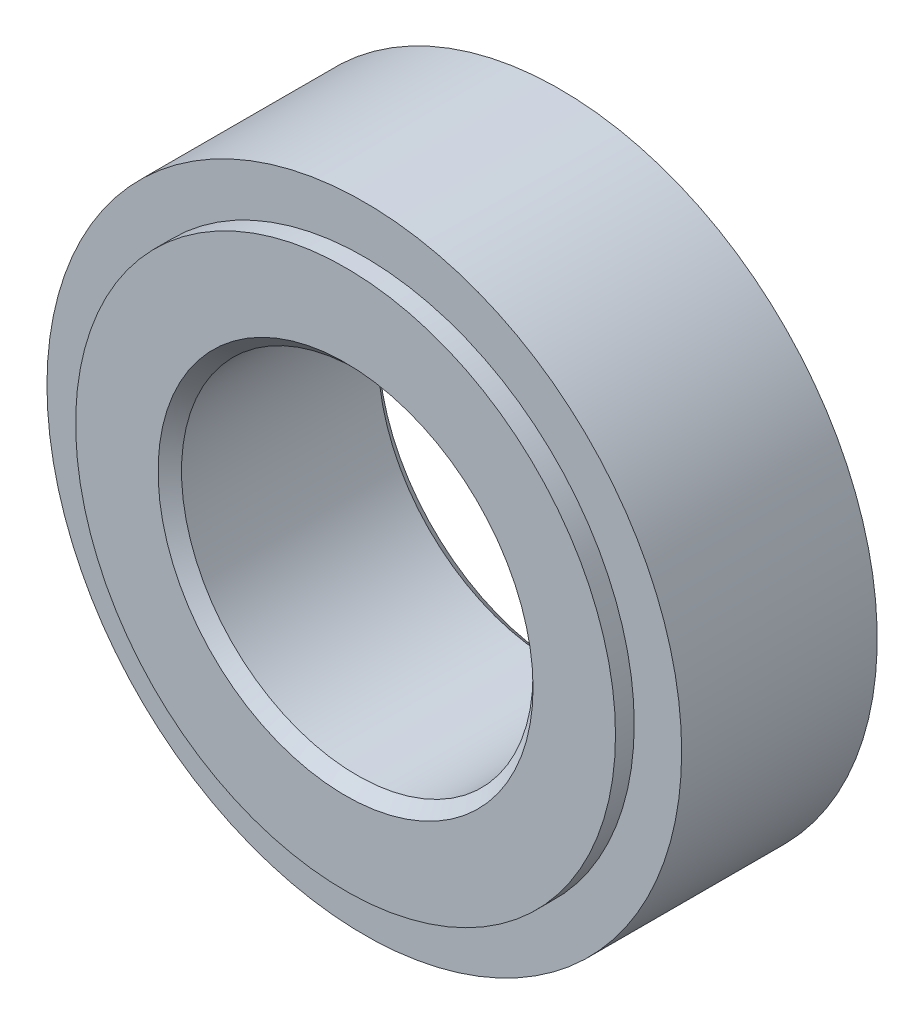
SolidWorks part; units mm, degrees
ref_plane "Front" through (0, 0, 0) normal (0, 0, 1) x (1, 0, 0)
ref_plane "Top" through (0, 0, 0) normal (0, 1, 0) x (1, 0, 0)
ref_plane "Right" through (0, 0, 0) normal (1, 0, 0) x (0, 0, -1)
sketch "Sketch1" plane through (0, 0, 0) normal (0, 0, 1) x (1, 0, 0)
  circle A0 centre (0, 0) radius 27.1
  dimension "OD" = 54.2
extrude "Extrude1" add sketch "Sketch1" along normal mid plane 18.8
sketch "Sketch2" plane through (0, 0, 9.4) normal (0, 0, 1) x (1, 0, 0)
  circle A0 centre (0, 0) radius 23.05
  dimension "MG" = 46.1
extrude "Cut-Extrude1" cut sketch "Sketch2" against normal blind 1.6 contours A0 M2
sketch "Sketch3" plane through (0, 0, -9.4) normal (0, 0, -1) x (-1, 0, 0)
  circle A0 centre (0, 0) radius 23.05
  dimension "MG" = 46.1
extrude "Cut-Extrude2" cut sketch "Sketch3" against normal blind 0.5 contours A0 M2
sketch "Sketch4" plane through (0, 0, 9.4) normal (0, 0, 1) x (1, 0, 0)
  circle A0 centre (0, 0) radius 15.01
  dimension "BORE" = 30.02
extrude "Cut-Extrude3" cut sketch "Sketch4" against normal through all
sketch "Sketch5" plane through (0, 0, -9.4) normal (0, 0, 1) x (1, 0, 0)
  point P0 (0, 18)
  point P1 (18, 0)
  point P2 (0, -18)
  point P3 (-18, 0)
  dimension "D1" = 18
  dimension "D2" = 18
  dimension "D3" = 18
  dimension "D4" = 18
hole_wizard "M5x0.8 Tapped Hole1" positions "3DSketch1" profile "Sketch6" tap size "M5x0.8" standard "Ansi Metric"
sketch3d "3DSketch1"
  point P0 (0, 32, -43.05)
  point P3 (-32, 0, -43.05)
  point P6 (32, 0, -43.05)
  point P9 (0, -32, -43.05)
sketch "Sketch6" plane through (0, 32, -43.05) normal (1, 0, 0) x (0, 1, 0)
  line L0 (0, 0) -> (0, 13.9618)
  line L1 (0, 13.9618) -> (2.1, 12.7)
  line L2 (2.1, 12.7) -> (2.1, 0)
  line L5 (2.1, 0) -> (0, 0)
  line L10 (0, 13.9618) -> (-2.1, 12.7) construction
  line L11 (0, -6.35) -> (0, 107.95) construction
  dimension "Tap Drill Dia." = 4.2
  dimension "Tap Drill Depth" = 12.7
  dimension "Drill Angle" = 118
chamfer "Chamfer1" distance 1 angle 45 2 edges at (15.01, 0, -9.4) (15.01, 0, 9.4)
sketch "Sketch7" plane through (0, 0, -39) normal (0, 0, -1) x (-1, 0, 0)
  point P0 (53.8815, 53.8815)
  point P1 (53.8815, -53.8815)
  point P3 (0, 76.2)
  point P4 (0, -76.2)
  point P5 (-53.8815, -53.8815)
  point P7 (-53.8815, 53.8815)
  dimension "D1" = 53.8815
  dimension "D2" = 53.8815
  dimension "D3" = 53.8815
  dimension "D4" = 53.8815
  dimension "D5" = 76.2
  dimension "D6" = 76.2
hole_wizard "Ø3.2 (3.2) Diameter Hole1" positions "3DSketch2" profile "Sketch8" hole size "Ø3.2" standard "Ansi Metric"
sketch3d "3DSketch2"
  point P0 (0, 76.2, -31.5)
  point P3 (0, -76.2, -31.5)
sketch "Sketch8" plane through (0, 76.2, -31.5) normal (1, 0, 0) x (0, 1, 0)
  line L0 (0, 0) -> (0, 4.8)
  line L1 (0, 4.8) -> (1.6, 4.8)
  line L2 (1.6, 4.8) -> (1.6, 0)
  line L5 (1.6, 0) -> (0, 0)
  line L10 (0, 4.8) -> (-1.6, 4.8) construction
  line L11 (0, -6.35) -> (0, 107.95) construction
  dimension "Hole Dia." = 3.2
  dimension "Hole Depth" = 4.8
  dimension "Drill Angle" = 180
hole_wizard "M6x1.0 Tapped Hole1" positions "3DSketch3" profile "Sketch9" tap size "M6x1.0" standard "Ansi Metric"
sketch3d "3DSketch3"
  point P0 (53.8815, 53.8815, -39)
  point P3 (-53.8815, 53.8815, -39)
  point P6 (-53.8815, -53.8815, -39)
  point P9 (53.8815, -53.8815, -39)
sketch "Sketch9" plane through (53.8815, 53.8815, -39) normal (1, 0, 0) x (0, 1, 0)
  line L0 (0, 0) -> (0, 14.2022)
  line L1 (0, 14.2022) -> (2.5, 12.7)
  line L2 (2.5, 12.7) -> (2.5, 0)
  line L5 (2.5, 0) -> (0, 0)
  line L10 (0, 14.2022) -> (-2.5, 12.7) construction
  line L11 (0, -6.35) -> (0, 107.95) construction
  dimension "Tap Drill Dia." = 5
  dimension "Tap Drill Depth" = 12.7
  dimension "Drill Angle" = 118
hole_wizard "Ø3.2 (3.2) Diameter Hole2" positions "3DSketch4" profile "Sketch10" hole size "Ø3.2" standard "Ansi Metric"
sketch3d "3DSketch4"
  point P1 (0, 6.8834, -34.4)
  point P4 (0, -6.8834, -34.4)
sketch "Sketch10" plane through (0, 6.8834, -34.4) normal (1, 0, 0) x (0, 1, 0)
  line L0 (0, 0) -> (0, 7.6)
  line L1 (0, 7.6) -> (1.6, 7.6)
  line L2 (1.6, 7.6) -> (1.6, 0)
  line L5 (1.6, 0) -> (0, 0)
  line L10 (0, 7.6) -> (-1.6, 7.6) construction
  line L11 (0, -6.35) -> (0, 107.95) construction
  dimension "Hole Dia." = 3.2
  dimension "Hole Depth" = 7.6
  dimension "Drill Angle" = 180
hole_wizard "M3x0.5 Tapped Hole1" positions "3DSketch5" profile "Sketch11" tap size "M3x0.5" standard "Ansi Metric"
sketch3d "3DSketch5"
  point P1 (6.8834, 0, -34.4)
  point P4 (-6.8834, 0, -34.4)
sketch "Sketch11" plane through (6.8834, 0, -34.4) normal (1, 0, 0) x (0, 1, 0)
  line L0 (0, 0) -> (0, 5.5511)
  line L1 (0, 5.5511) -> (1.25, 4.8)
  line L2 (1.25, 4.8) -> (1.25, 0)
  line L5 (1.25, 0) -> (0, 0)
  line L10 (0, 5.5511) -> (-1.25, 4.8) construction
  line L11 (0, -6.35) -> (0, 107.95) construction
  dimension "Tap Drill Dia." = 2.5
  dimension "Tap Drill Depth" = 4.8
  dimension "Drill Angle" = 118
hole_wizard "M4x0.7 Tapped Hole1" positions "3DSketch6" profile "Sketch12" tap size "M4x0.7" standard "Ansi Metric"
sketch3d "3DSketch6"
  point P0 (0, 18, -9.4)
  point P3 (18, 0, -9.4)
  point P6 (0, -18, -9.4)
  point P9 (-18, 0, -9.4)
sketch "Sketch12" plane through (0, 18, -9.4) normal (1, 0, 0) x (0, 1, 0)
  line L0 (0, 0) -> (0, 8.9914)
  line L1 (0, 8.9914) -> (1.65, 8)
  line L2 (1.65, 8) -> (1.65, 0)
  line L5 (1.65, 0) -> (0, 0)
  line L10 (0, 8.9914) -> (-1.65, 8) construction
  line L11 (0, -6.35) -> (0, 107.95) construction
  dimension "Tap Drill Dia." = 3.3
  dimension "Tap Drill Depth" = 8
  dimension "Drill Angle" = 118
hole_wizard "M6x1.0 Tapped Hole2" positions "3DSketch7" profile "Sketch13" tap size "M6x1.0" standard "Ansi Metric"
sketch3d "3DSketch7"
  point P0 (-18, 0, -9.4)
  point P3 (0, 18, -9.4)
  point P6 (0, -18, -9.4)
  point P9 (18, 0, -9.4)
sketch "Sketch13" plane through (-18, 0, -9.4) normal (1, 0, 0) x (0, 1, 0)
  line L0 (0, 0) -> (0, 14.2022)
  line L1 (0, 14.2022) -> (2.5, 12.7)
  line L2 (2.5, 12.7) -> (2.5, 0)
  line L5 (2.5, 0) -> (0, 0)
  line L10 (0, 14.2022) -> (-2.5, 12.7) construction
  line L11 (0, -6.35) -> (0, 107.95) construction
  dimension "Tap Drill Dia." = 5
  dimension "Tap Drill Depth" = 12.7
  dimension "Drill Angle" = 118
